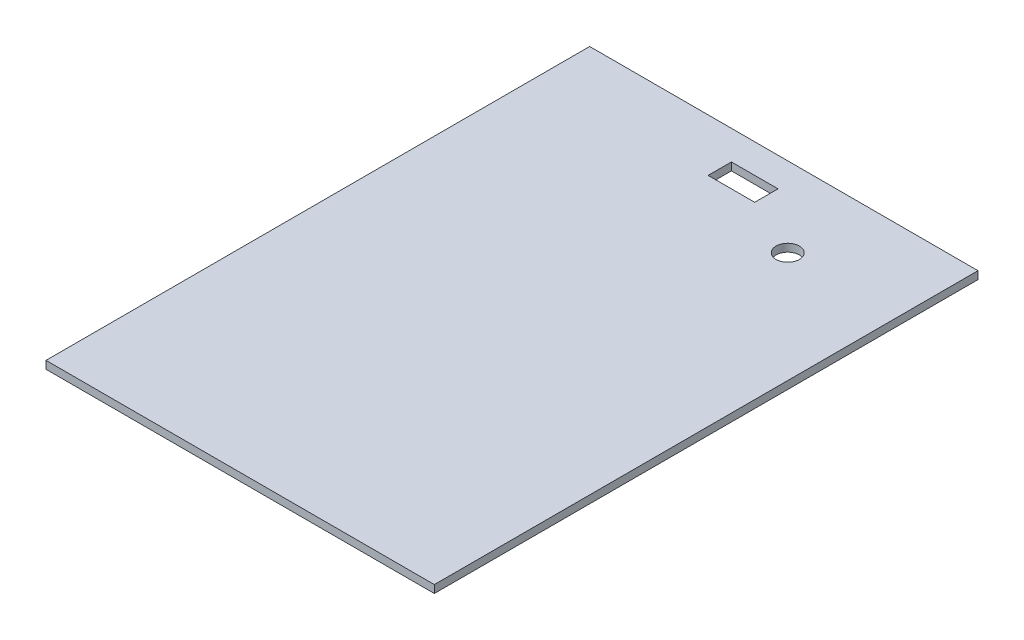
SolidWorks part; units mm, degrees
ref_plane "Plan de face" through (0, 0, 0) normal (0, 0, 1) x (1, 0, 0)
ref_plane "Plan de dessus" through (0, 0, 0) normal (0, 1, 0) x (1, 0, 0)
ref_plane "Plan de droite" through (0, 0, 0) normal (1, 0, 0) x (0, 0, -1)
sketch "Esquisse1" plane through (0, 0, 0) normal (0, 1, 0) x (1, 0, 0)
  line L0 (-11.9041, -2.5) -> (129.2328, -2.5) construction
  line L1 (0, 0) -> (95, 0) construction
  line L2 (0, 0) -> (0, 135) construction
  line L3 (0, 135) -> (95, 135) construction
  line L4 (95, 0) -> (95, 135) construction
  line L5 (97.5, -9.2521) -> (97.5, 146.0833) construction
  line L6 (103.5908, 137.5) -> (-20.1689, 137.5) construction
  line L7 (-2.5, 162.8247) -> (-2.5, -12.007) construction
  line L8 (69, 162.8247) -> (69, 94.1635) construction
  line L9 (47.5, 148.8382) -> (47.5, 114.0838) construction
  line L10 (58.6643, 117) -> (111.2198, 117) construction
  line L11 (29.5528, 127) -> (129.2328, 127) construction
  line L12 (32.6013, 130) -> (56.8565, 130) construction
  line L13 (56.8565, 124) -> (32.6013, 124) construction
  line L14 (41.5, 133.4438) -> (41.5, 119.628) construction
  line L15 (53.5, 133.4438) -> (53.5, 119.628) construction
  line L17 (41.5, 130) -> (53.5, 130)
  line L18 (41.5, 130) -> (41.5, 124)
  line L19 (41.5, 124) -> (53.5, 124)
  line L20 (53.5, 130) -> (53.5, 124)
  line L21 (-2.5, 137.5) -> (97.5, 137.5)
  line L22 (-2.5, 137.5) -> (-2.5, -2.5)
  line L23 (-2.5, -2.5) -> (97.5, -2.5)
  line L24 (97.5, 137.5) -> (97.5, -2.5)
  circle A0 centre (69, 117) radius 3
  dimension "D1" = 2.5
  dimension "D2" = 2.5
  dimension "D3" = 2.5
  dimension "D4" = 2.5
  dimension "D5" = 47.5
  dimension "D6" = 69
  dimension "D7" = 117
  dimension "D8" = 127
  dimension "D9" = 6
  dimension "D10" = 12
  dimension "D11" = 3
  dimension "D12" = 6
extrude "Extrusion1" add sketch "Esquisse1" along normal blind 2
